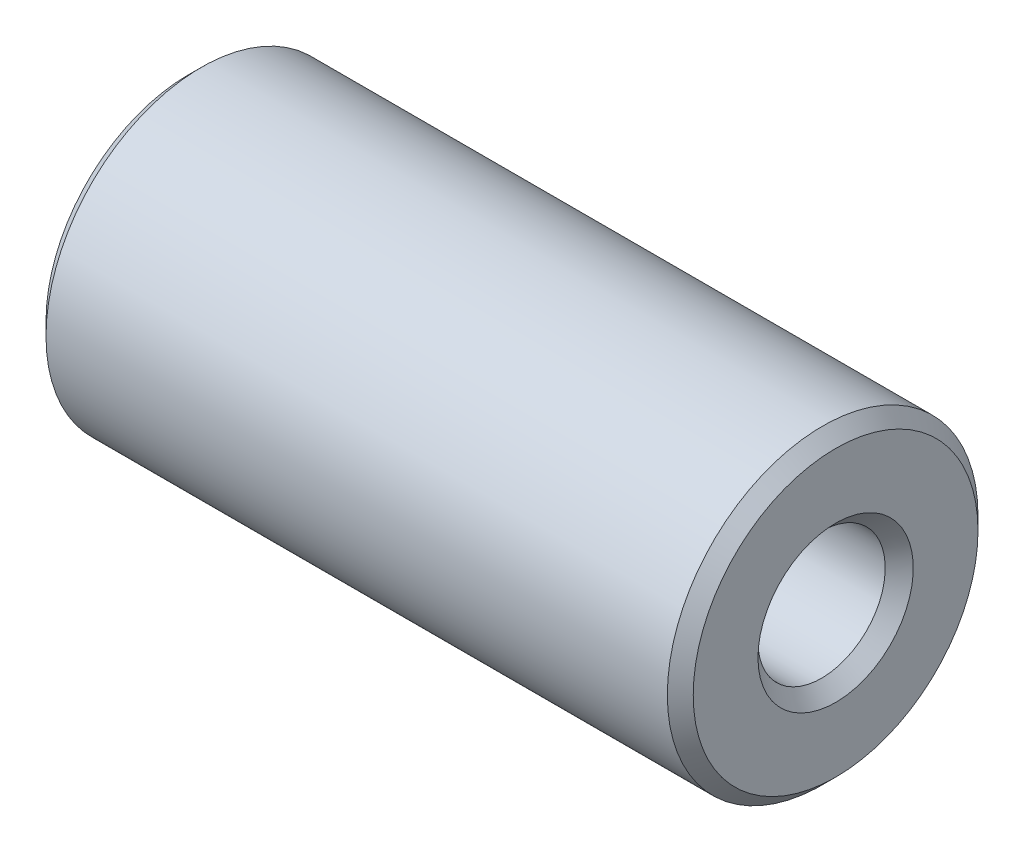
SolidWorks part; units mm, degrees
ref_plane "Front Plane" through (0, 0, 0) normal (0, 0, 1) x (1, 0, 0)
ref_plane "Top Plane" through (0, 0, 0) normal (0, 1, 0) x (1, 0, 0)
ref_plane "Right Plane" through (0, 0, 0) normal (1, 0, 0) x (0, 0, -1)
ref_plane "Plane1" through (0, 0, 0) normal (0, 0, -1) x (-1, 0, 0)
sketch "Sketch1" plane through (0, 0, 0) normal (0, 0, -1) x (-1, 0, 0)
  line L0 (-25, 3) -> (-24.4585, 2.4585)
  line L1 (-24.4585, 2.4585) -> (-0.5415, 2.4585)
  line L2 (-0.5415, 2.4585) -> (0, 3)
  line L3 (0, 3) -> (0, 5.5)
  line L4 (0, 5.5) -> (-0.5, 6)
  line L5 (-0.5, 6) -> (-24.5, 6)
  line L6 (-24.5, 6) -> (-25, 5.5)
  line L7 (-25, 5.5) -> (-25, 3)
  line L8 (-25, 0) -> (0, 0) construction
revolve "Revolve1" add sketch "Sketch1" angle 360 about L8
